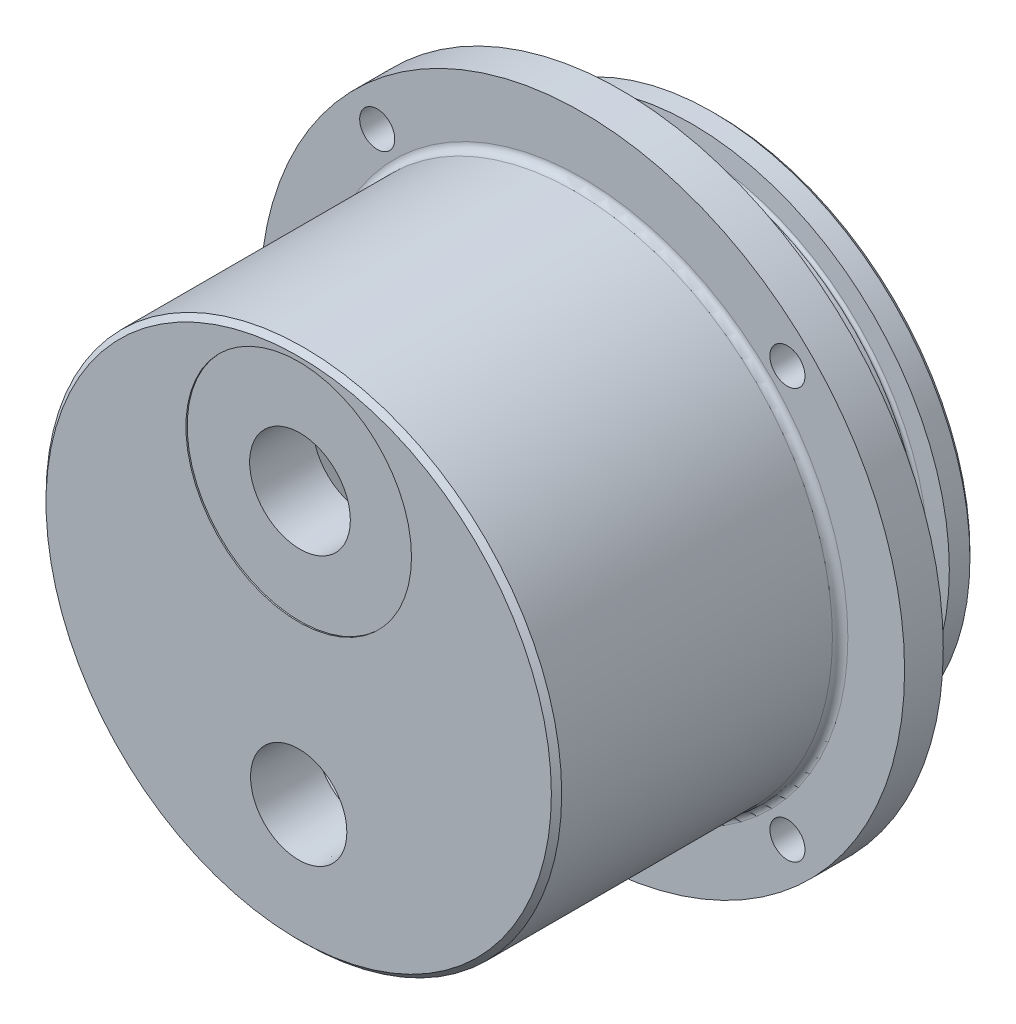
SolidWorks part; units mm, degrees
ref_plane "Front" through (0, 0, 0) normal (0, 0, 1) x (1, 0, 0)
ref_plane "Top" through (0, 0, 0) normal (0, 1, 0) x (1, 0, 0)
ref_plane "Right" through (0, 0, 0) normal (1, 0, 0) x (0, 0, -1)
sketch "Sketch1" plane through (0, 0, 0) normal (0, 0, 1) x (1, 0, 0)
  circle A0 centre (0, 0) radius 19.05
  circle A1 centre (0, 0) radius 25.3619
  dimension "D2" = 38.1
  dimension "D1" = 50.7238
extrude "Extrude1" add sketch "Sketch1" against normal blind 9.525
sketch "Sketch2" plane through (0, 0, 0) normal (0, 0, 1) x (1, 0, 0)
  circle A0 centre (0, 0) radius 19.05 construction
  circle A1 centre (0, 0) radius 19.05
  circle A4 centre (0, 0) radius 31.75
  dimension "D1" = 63.5
extrude "Extrude3" add sketch "Sketch2" along normal blind 25.4
sketch "Sketch3" plane through (0, 0, 25.4) normal (0, 0, 1) x (1, 0, 0)
  circle A0 centre (0, 0) radius 31.75 construction
  circle A1 centre (0, 0) radius 31.75
extrude "Extrude4" add sketch "Sketch3" along normal blind 6.35
chamfer "Chamfer1" distance 0.508 angle 45 2 edges at (25.3619, 0, -9.525) (19.05, 0, -9.525)
sketch "Sketch4" plane through (0, 0, 31.75) normal (0, 0, 1) x (1, 0, 0)
  circle A0 centre (-20.2056, 20.2056) radius 1.7272
  circle A1 centre (20.2056, 20.2056) radius 1.7272
  circle A2 centre (-20.2056, -20.2056) radius 1.7272
  circle A3 centre (20.2056, -20.2056) radius 1.7272
  dimension "D1" = 3.4544
  dimension "D2" = 3.4544
  dimension "D3" = 3.4544
  dimension "D4" = 3.4544
extrude "Cut-Extrude1" cut sketch "Sketch4" against normal through all
sketch "Sketch5" plane through (0, 0, 31.75) normal (0, 0, 1) x (1, 0, 0)
  line L0 (0, 38.3554) -> (0, -37.3149) construction
  circle A2 centre (0, 0) radius 13.335 construction
  point P3 (0, -13.335)
  dimension "D1" = 13.335
ref_plane "Plane1" through (0, 0, -9.525) normal (-1, 0, 0) x (0, -1, 0)
ref_plane "Plane2" through (0, 0, -9.525) normal (-1, 0, 0) x (0, -1, 0)
sketch "Sketch9" plane through (0, 0, -9.525) normal (-1, 0, 0) x (0, -1, 0)
  line L0 (23.3889, 6.2584) -> (25.3619, 6.431)
  line L1 (25.3619, 6.431) -> (25.3619, 2.54)
  line L2 (25.3619, 2.54) -> (23.4556, 2.7068)
  line L3 (23.2156, 3.0712) -> (23.2156, 6.1212)
  line L4 (0, 50) -> (0, -50) construction
  line L5 (-24.8539, 0) -> (24.8539, 0) construction
  line L6 (25.3619, 0.508) -> (25.3619, 9.525) construction
  arc A0 (23.4556, 2.7068) -> (23.2156, 3.0712) centre (23.4442, 2.9605) cw
  arc A1 (23.2156, 6.1212) -> (23.3889, 6.2584) centre (23.4442, 6.0105) cw
  dimension "D4" = 0.254
  dimension "D5" = 0.254
  dimension "D1" = 3.891
  dimension "D2" = 3.0499
  dimension "D3" = 2.1463
  dimension "D6" = 85
  dimension "D7" = 85
  dimension "D8" = 2.54
revolve "Groove for AS 568-133, O-Ring1" cut sketch "Sketch9"
sketch "Sketch11" plane through (0, 0, 31.75) normal (0, 0, 1) x (1, 0, 0)
  circle A0 centre (0, 0) radius 25.4
  circle A1 centre (0, 0) radius 40.6261
  dimension "D1" = 50.8
extrude "Cut-Extrude3" cut sketch "Sketch11" against normal blind 27.94
fillet "Fillet1" radius 0.762 1 edges at (25.4, 0, 3.81)
chamfer "Chamfer2" distance 0.508 angle 45 1 edges at (25.4, 0, 31.75)
sketch "Sketch12" plane through (0, 0, 31.75) normal (0, 0, 1) x (1, 0, 0)
  circle A0 centre (0, 0) radius 24.892 construction
  point P0 (0, 13.335)
  dimension "D1" = 13.335
hole_wizard "7/16-20 Tapped Hole1" positions "3DSketch1" profile "Sketch13" tap size "7/16-20" standard "Ansi Inch"
sketch3d "3DSketch1"
  point P0 (0, 13.335, 31.75)
sketch "Sketch13" plane through (0, 13.335, 31.75) normal (1, 0, 0) x (0, -1, 0)
  line L0 (0, 0) -> (0, 31.5556)
  line L1 (0, 31.5556) -> (4.9606, 28.575)
  line L2 (4.9606, 28.575) -> (4.9606, 0)
  line L5 (4.9606, 0) -> (0, 0)
  line L10 (0, 31.5556) -> (-4.9606, 28.575) construction
  line L11 (0, -6.35) -> (0, 107.95) construction
  dimension "Tap Drill Dia." = 9.9212
  dimension "Tap Drill Depth" = 28.575
  dimension "Drill Angle" = 118
hole_wizard "1/8 NPT Tapped Hole1" positions "3DSketch2" profile "Sketch15" size "1/8" standard "Ansi Inch"
sketch3d "3DSketch2"
  point P0 (0, -13.335, 31.75)
sketch "Sketch15" plane through (0, -13.335, 31.75) normal (1, 0, 0) x (0, -1, 0)
  line L0 (0, 0) -> (0, 14.2175)
  line L1 (4.2164, 11.684) -> (0, 14.2175)
  line L2 (-4.2164, 11.684) -> (0, 14.2175) construction
  line L3 (4.2164, 11.684) -> (4.2164, 6.858)
  line L4 (4.2164, 6.858) -> (4.5374, 6.858)
  line L5 (4.5374, 6.858) -> (4.7427, 0)
  line L6 (-4.5374, 6.858) -> (-4.7427, 0) construction
  line L7 (4.7427, 0) -> (0, 0)
  line L8 (0, -6.35) -> (0, 107.95) construction
  line L11 (-4.2164, 6.858) -> (-4.5374, 6.858) construction
  dimension "Tap Drill Dia." = 8.4328
  dimension "Tap Drill Depth" = 11.684
  dimension "Thread Dia." = 9.4855
  dimension "Thread Angle" = 3.43
  dimension "Thread Depth" = 6.858
  dimension "Drill Angle" = 118
sketch "Sketch16" plane through (0, 0, 31.75) normal (0, 0, 1) x (1, 0, 0)
  circle A0 centre (0, 13.335) radius 11.1125
extrude "Cut-Extrude4" cut sketch "Sketch16" against normal blind 0.127
fillet "Fillet2" radius 0.762 1 edges at (19.05, 0, 25.4)
